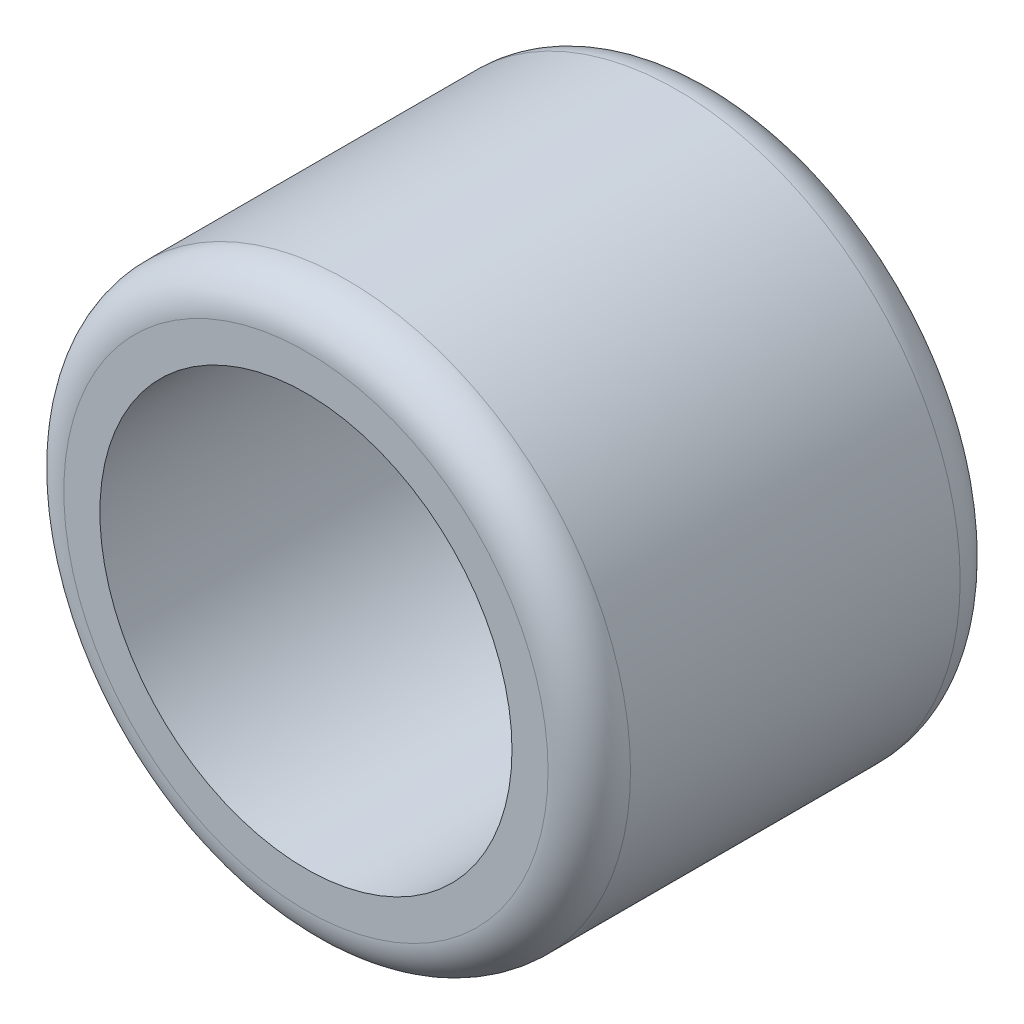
SolidWorks part; units mm, degrees
ref_plane "Front Plane" through (0, 0, 0) normal (0, 0, 1) x (1, 0, 0)
ref_plane "Top Plane" through (0, 0, 0) normal (0, 1, 0) x (1, 0, 0)
ref_plane "Right Plane" through (0, 0, 0) normal (1, 0, 0) x (0, 0, -1)
sketch "Sketch1" plane through (0, 0, 0) normal (0, 0, 1) x (1, 0, 0)
  circle A0 centre (0, 0) radius 6.35
  circle A1 centre (0, 0) radius 8.7312
  dimension "D1" = 17.4625
  dimension "D2" = 12.7
extrude "Boss-Extrude1" add sketch "Sketch1" along normal blind 12.7
fillet "Fillet1" radius 1.27 2 edges at (8.7312, 0, 0) (8.7312, 0, 12.7)
